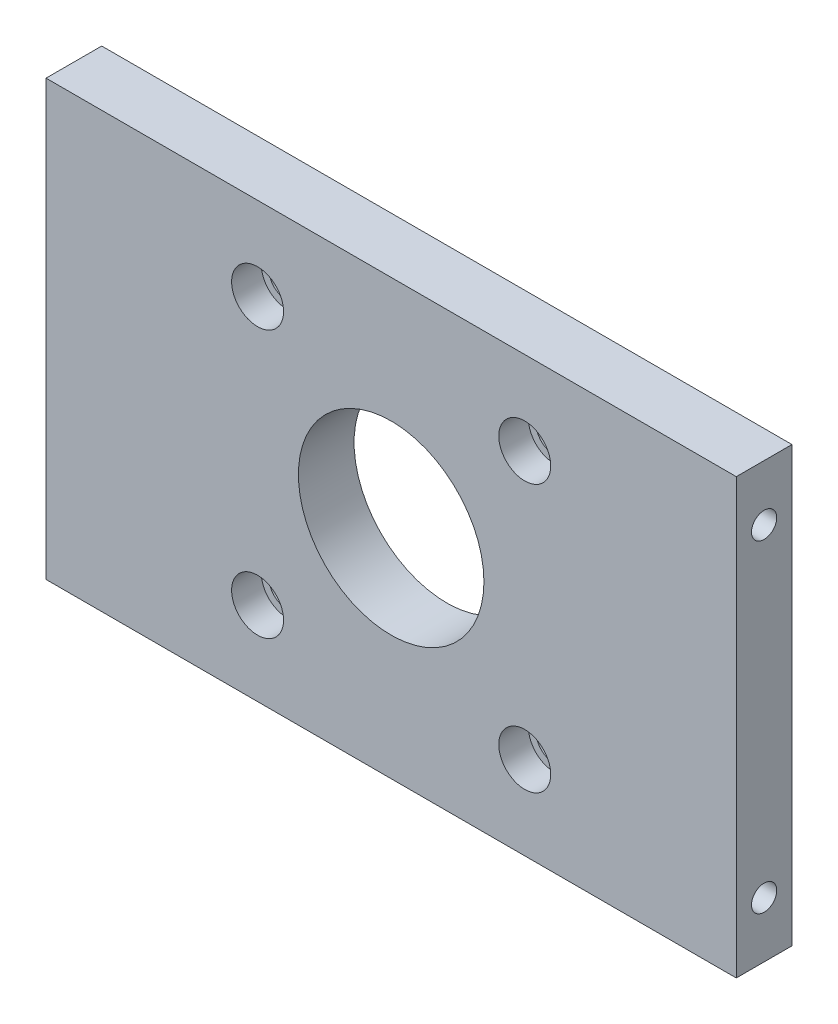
SolidWorks part; units mm, degrees
ref_plane "Face" through (0, 0, 0) normal (0, 0, 1) x (1, 0, 0)
ref_plane "Dessus" through (0, 0, 0) normal (0, 1, 0) x (1, 0, 0)
ref_plane "Droite" through (0, 0, 0) normal (1, 0, 0) x (0, 0, -1)
sketch "Esquisse1" plane through (0, 0, 0) normal (0, 0, 1) x (1, 0, 0)
  line L1 (-69.9731, 63.6935) -> (116.0269, 63.6935)
  line L2 (-69.9731, 63.6935) -> (-69.9731, -53.3065)
  line L3 (-69.9731, -53.3065) -> (116.0269, -53.3065)
  line L4 (116.0269, 63.6935) -> (116.0269, -53.3065)
  dimension "D1" = 186
  dimension "D2" = 117
extrude "Base-Extrusion" add sketch "Esquisse1" along normal blind 15
sketch "Esquisse2" plane through (0, 0, 15) normal (0, 0, 1) x (1, 0, 0)
  line L0 (-69.9731, -53.3065) -> (116.0269, -53.3065) construction
  line L1 (-69.9731, 63.6935) -> (-69.9731, -53.3065) construction
  circle A0 centre (23.0269, 5.1935) radius 25
  dimension "D1" = 50
  dimension "D2" = 58.5
  dimension "D3" = 93
extrude "Enlèv. mat.-Extru.1" cut sketch "Esquisse2" against normal blind 15
hole_wizard "Chambrage pour vis à tête cylindrique à 6 pans creux (vis CHC) M61" positions "Esquisse4" profile "Esquisse3" counterbore size "M6" standard "ISO"
sketch "Esquisse4" plane through (0, 0, 15) normal (0, 0, 1) x (1, 0, 0)
  circle A0 centre (23.0269, 5.1935) radius 25 construction
  point P0 (-12.9731, 41.1935)
  point P1 (-12.9731, -30.8065)
  point P2 (59.0269, -30.8065)
  point P3 (59.0269, 41.1935)
  dimension "D1" = 36
  dimension "D2" = 72
  dimension "D3" = 36
  dimension "D4" = 36
  dimension "D5" = 72
  dimension "D6" = 72
  dimension "D7" = 36
  dimension "D8" = 72
sketch "Esquisse3" plane through (-12.9731, 41.1935, 15) normal (1, 0, 0) x (0, -1, 0)
  line L0 (0, 0) -> (0, 48.0043)
  line L1 (0, 48.0043) -> (5, 45)
  line L2 (5, 45) -> (5, 8)
  line L3 (5, 8) -> (7, 8)
  line L4 (7, 8) -> (7, 0)
  line L5 (7, 0) -> (0, 0)
  line L10 (0, 48.0043) -> (-5, 45) construction
  line L11 (0, -6.35) -> (0, 107.95) construction
  dimension "Diamètre du perçage" = 10
  dimension "Profondeur du perçage" = 45
  dimension "Diamètre du chambrage" = 14
  dimension "Profondeur du chambrage" = 8
  dimension "Angle de pointe" = 118
hole_wizard "Trou taraudé M8x1.251" positions "Esquisse6" profile "Esquisse5" tap size "M8x1.25" standard "ISO"
sketch "Esquisse6" plane through (-69.9731, 0, 0) normal (-1, 0, 0) x (0, 0, 1)
  line L0 (15, 63.6935) -> (0, 63.6935) construction
  line L1 (0, -53.3065) -> (0, 63.6935) construction
  point P0 (7.5, 48.6935)
  point P1 (7.5, -38.3065)
  dimension "D1" = 87
  dimension "D2" = 15
  dimension "D3" = 7.5
  dimension "D4" = 7.5
sketch "Esquisse5" plane through (-69.9731, 48.6935, 7.5) normal (0, 1, 0) x (0, 0, 1)
  line L0 (0, 0) -> (0, 48.2929)
  line L1 (0, 48.2929) -> (3.4, 46.25)
  line L2 (3.4, 46.25) -> (3.4, 0)
  line L5 (3.4, 0) -> (0, 0)
  line L10 (0, 48.2929) -> (-3.4, 46.25) construction
  line L11 (0, -6.35) -> (0, 107.95) construction
  dimension "Diamètre du perçage" = 6.8
  dimension "Profondeur du perçage" = 46.25
  dimension "Angle de pointe" = 118
hole_wizard "Trou taraudé M8x1.252" positions "Esquisse8" profile "Esquisse7" tap size "M8x1.25" standard "ISO"
sketch "Esquisse8" plane through (116.0269, 0, 0) normal (1, 0, 0) x (0, 0, -1)
  line L0 (-15, 63.6935) -> (0, 63.6935) construction
  line L1 (0, -53.3065) -> (0, 63.6935) construction
  point P0 (-7.5, 48.6935)
  point P1 (-7.5, -38.3065)
  dimension "D1" = 15
  dimension "D2" = 87
  dimension "D3" = 7.5
  dimension "D4" = 7.5
sketch "Esquisse7" plane through (116.0269, 48.6935, 7.5) normal (0, 1, 0) x (0, 0, -1)
  line L0 (0, 0) -> (0, 48.2929)
  line L1 (0, 48.2929) -> (3.4, 46.25)
  line L2 (3.4, 46.25) -> (3.4, 0)
  line L5 (3.4, 0) -> (0, 0)
  line L10 (0, 48.2929) -> (-3.4, 46.25) construction
  line L11 (0, -6.35) -> (0, 107.95) construction
  dimension "Diamètre du perçage" = 6.8
  dimension "Profondeur du perçage" = 46.25
  dimension "Angle de pointe" = 118
